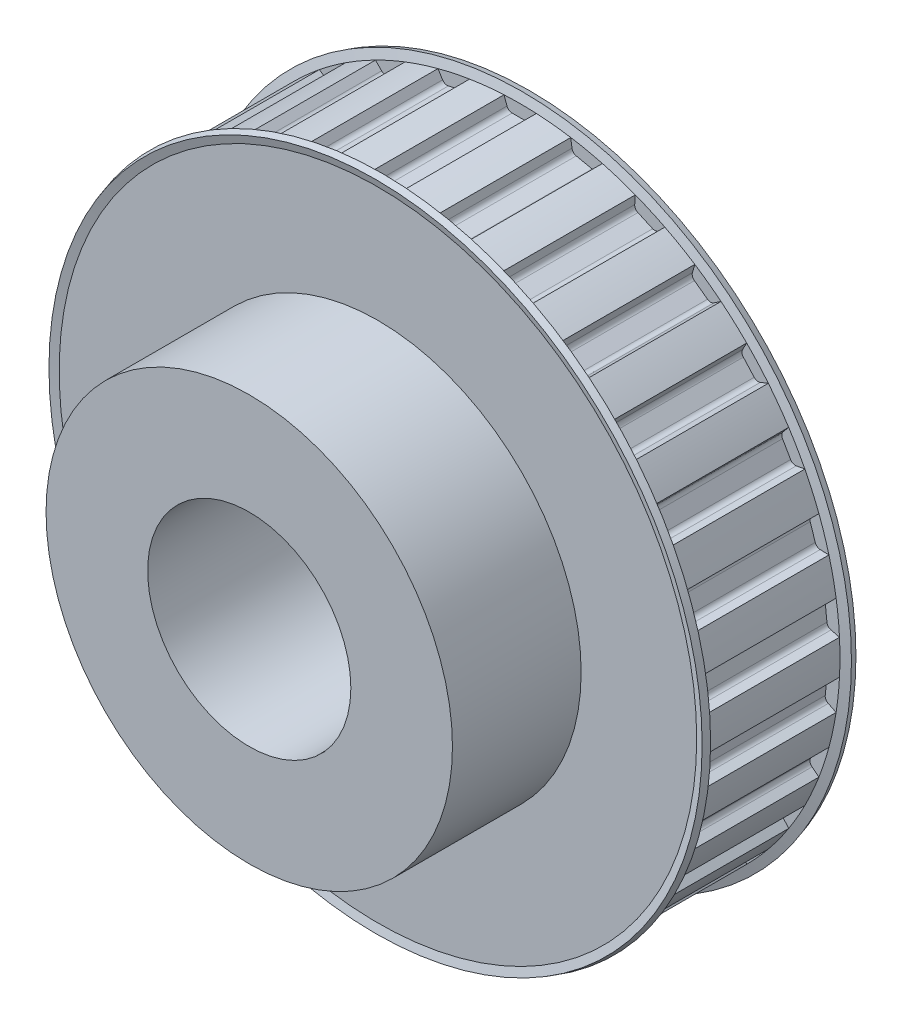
SolidWorks part; units mm, degrees
ref_plane "Plane1" through (0, 0, 0) normal (0, 0, 1) x (1, 0, 0)
ref_plane "Plane2" through (0, 0, 0) normal (0, 1, 0) x (1, 0, 0)
ref_plane "Plane3" through (0, 0, 0) normal (1, 0, 0) x (0, 0, -1)
sketch "Clipboard" plane through (0, 0, 0) normal (0, 0, 1) x (1, 0, 0)
  line L0 (0, 0) -> (42.3926, 0)
  line L1 (0, 0) -> (43.9941, 25.4)
  line L2 (0, 0) -> (43.9941, -25.4)
  dimension "Overall_len" = 50.8
  dimension "T_dim" = 42.3926
  dimension "OAL" = 50.8
  dimension "Show_grvs" = 30
  dimension "Num_grvs" = 30
sketch "Sketch1" plane through (0, 0, 0) normal (0, 0, 1) x (1, 0, 0)
  circle A0 centre (0, 0) radius 59.9567
  dimension "Outside_dia" = 119.9134
extrude "BasePulley" add sketch "Sketch1" against normal blind 25.4
sketch "Sketch2" plane through (0, 0, 0) normal (1, 0, 0) x (0, 0, -1)
  line L0 (25.4, 59.9567) -> (25.9048, 61.6077)
  line L1 (25.9048, 61.6077) -> (27.1193, 61.2364)
  line L2 (12.7, 0) -> (12.7, 66.675) construction
  line L3 (27.1193, 61.2364) -> (26.67, 59.7669)
  line L4 (26.67, 59.7669) -> (26.67, 0)
  line L5 (0, 59.9567) -> (-0.5048, 61.6077)
  line L6 (25.4, -59.9567) -> (25.4, 59.9567) construction
  line L7 (-0.5048, 61.6077) -> (-1.7193, 61.2364)
  line L8 (-1.7193, 61.2364) -> (-1.27, 59.7669)
  line L9 (-1.27, 59.7669) -> (-1.27, 0)
  line L10 (25.4, 59.9567) -> (0, 59.9567)
  line L11 (0, 0) -> (38.2092, 0) construction
  line L12 (25.4, 0) -> (0, 0) construction
  line L13 (-1.27, 0) -> (26.67, 0)
  dimension "D1" = 12.7
  dimension "Flange_ang" = 17
  dimension "Flange_thickness" = 1.27
  dimension "D2" = 59.9567
  dimension "Flange_ht" = 1.651
  dimension "D3" = 1.27
revolve "Flange" add sketch "Sketch2" angle 360 about L11
ref_plane "Plane4" through (0, 0, -12.7) normal (0, 0, 1) x (1, 0, 0)
sketch "Sketch3" plane through (0, 0, -12.7) normal (0, 0, 1) x (1, 0, 0)
  line L0 (-3.0607, 59.9567) -> (-3.0607, 85.3567)
  line L1 (3.0607, 59.9567) -> (3.0607, 85.3567)
  line L2 (0, 0) -> (0, 59.9567) construction
  line L3 (-3.0607, 59.9567) -> (3.0607, 59.9567) construction
  line L4 (-1.5173, 57.6707) -> (1.5173, 57.6707)
  line L5 (3.0607, 59.9567) -> (2.472, 58.3392)
  line L6 (-3.0607, 59.9567) -> (-2.472, 58.3392)
  line L7 (3.0607, 85.3567) -> (-3.0607, 85.3567)
  arc A0 (1.5173, 57.6707) -> (2.472, 58.3392) centre (1.5173, 58.6867) ccw
  arc A2 (-2.472, 58.3392) -> (-1.5173, 57.6707) centre (-1.5173, 58.6867) ccw
  dimension "Grv_rad_bot" = 1.016
  dimension "D4" = 25.4
  dimension "D1" = 59.9567
  dimension "Grv_ang" = 40
  dimension "Grv_width" = 6.1214
  dimension "D3" = 20
  dimension "Grv_depth" = 2.286
extrude "Groove" cut sketch "Sketch3" against normal mid plane 25.4
pattern_circular "Grooves" count 30 every 12 about axis through (0, 0, -25.4) along (0, 0, 1) of "Groove"
sketch "Sketch4" plane through (0, 0, 0) normal (1, 0, 0) x (0, 0, -1)
  line L0 (0, 0) -> (47.6781, 0) construction
  line L1 (25.4, 0) -> (0, 0) construction
  line L2 (0, 0) -> (-25.4, 0)
  line L3 (-25.4, 0) -> (-25.4, 38.1)
  line L4 (-25.4, 38.1) -> (0, 38.1)
  line L5 (0, 38.1) -> (0, 0)
  line L6 (-25.4, -38.1) -> (0, -38.1) construction
  dimension "Hub_dia" = 76.2
  dimension "Hub_depth" = 25.4
revolve "BaseHub" add sketch "Sketch4" angle 360 about L0
sketch "BorSke" plane through (0, 0, 25.4) normal (0, 0, 1) x (1, 0, 0)
  circle A0 centre (0, 0) radius 19.05
  dimension "Diameter" = 38.1
extrude "Bore" cut sketch "BorSke" against normal through all
sketch "KeySke" plane through (0, 0, 25.4) normal (0, 0, 1) x (1, 0, 0)
  line L0 (3.175, 23.3426) -> (3.175, 0)
  line L1 (3.175, 23.3426) -> (-3.175, 23.3426)
  line L2 (-3.175, 23.3426) -> (-3.175, 0)
  line L3 (-3.175, 0) -> (3.175, 0)
  line L4 (0, 31.75) -> (0, -3.175) construction
  dimension "Width" = 6.35
  dimension "Offset" = 23.3426
extrude "Keyway" [suppressed] cut sketch "KeySke" against normal through all
pattern_circular "Keyway2" [suppressed] count 2 every 90
equation "\"D1@Plane4\" = \"Width@BasePulley\" / 2"
equation "\"D1@Groove\" = \"Width@BasePulley\""
equation "\"D1@Sketch3\" = \"Outside_dia@Sketch1\" / 2"
equation "\"D1@Sketch2\" = \"Width@BasePulley\" / 2"
equation "\"D2@Sketch2\" = \"Outside_dia@Sketch1\" / 2"
equation "\"D3@Sketch2\" = \"Flange_thickness@Sketch2\""
equation "\"Num_grvs@Clipboard\" = int( \"Num_grvs@Clipboard\" )"
equation "\"Show_grvs@Clipboard\" = int( \"Show_grvs@Clipboard\" )"
equation "\"Show_grvs@Clipboard\" = ((sgn( \"Show_grvs@Clipboard\" - \"Num_grvs@Clipboard\" )-1)*( \"Show_grvs@Clipboard\" - \"Num_grvs@Clipboard\" ))/-2+ \"Num_grvs@Clipboard\""
equation "\"Show_grvs@Clipboard\" = ((sgn( \"Show_grvs@Clipboard\" - 1.0)+1)*( \"Show_grvs@Clipboard\" - 1.0))/2 +1.0"
equation "\"Angle@Grooves\" = 360.0 / \"Num_grvs@Clipboard\""
equation "\"Num_grvs@Grooves\" =  \"Show_grvs@Clipboard\""
equation "\"Offset@KeySke\" = \"T_dim@Clipboard\" - \"Diameter@BorSke\" / 2.0"
equation "\"OAL@Clipboard\" = \"Overall_len@Clipboard\""
equation "\"Hub_depth@Sketch4\" = \"OAL@Clipboard\" - \"Width@BasePulley\""
